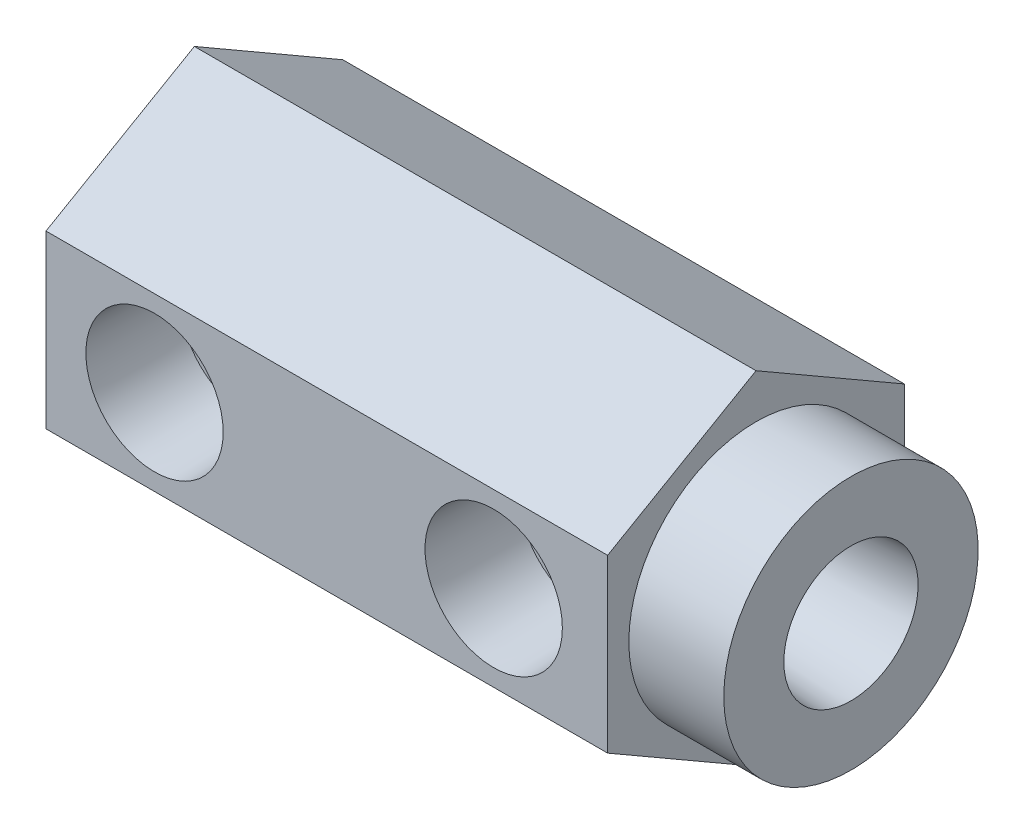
SolidWorks part; units mm, degrees
ref_plane "Front Plane" through (0, 0, 0) normal (0, 0, 1) x (1, 0, 0)
ref_plane "Top Plane" through (0, 0, 0) normal (0, 1, 0) x (1, 0, 0)
ref_plane "Right Plane" through (0, 0, 0) normal (1, 0, 0) x (0, 0, -1)
sketch "Sketch1" plane through (0, 0, 0) normal (1, 0, 0) x (0, 0, -1)
  line L0 (0, 14.1148) -> (0, -14.1148) construction
  line L1 (-11.1125, -6.4158) -> (0, -12.8316)
  line L2 (0, -12.8316) -> (11.1125, -6.4158)
  line L3 (11.1125, -6.4158) -> (11.1125, 6.4158)
  line L4 (11.1125, 6.4158) -> (0, 12.8316)
  line L5 (0, 12.8316) -> (-11.1125, 6.4158)
  line L6 (-11.1125, 6.4158) -> (-11.1125, -6.4158)
  circle A0 centre (0, 0) radius 11.1125 construction
  dimension "D1" = 22.225
extrude "Boss-Extrude1" add sketch "Sketch1" along normal blind 42.0624 separate body
sketch "Sketch2" plane through (0, 0, 0) normal (-1, 0, 0) x (0, 0, 1)
  circle A1 centre (0, 0) radius 9.525
  dimension "D1" = 19.05
extrude "Boss-Extrude2" add sketch "Sketch2" against normal blind 49.1744
hole_wizard "1/8 NPT Tapped Hole1" positions "Sketch4" profile "Sketch3" size "1/8" standard "Ansi Inch"
sketch "Sketch4" plane through (0, 0, 11.1125) normal (0, 0, 1) x (1, 0, 0)
  line L0 (12.2238, 0) -> (-12.2238, 0) construction
  line L1 (0, -12.2237) -> (0, 12.2238) construction
  point P0 (8.128, 0)
  point P1 (33.528, 0)
  dimension "D1" = 8.128
  dimension "D2" = 25.4
sketch "Sketch3" plane through (8.128, 0, 11.1125) normal (1, 0, 0) x (0, -1, 0)
  line L0 (0, 0) -> (0, 18.4085)
  line L1 (4.2164, 15.875) -> (0, 18.4085)
  line L2 (-4.2164, 15.875) -> (0, 18.4085) construction
  line L3 (4.2164, 15.875) -> (4.2164, 6.924)
  line L4 (4.2164, 6.924) -> (4.9362, 6.924)
  line L5 (4.9362, 6.924) -> (5.1435, 0)
  line L6 (-4.9362, 6.924) -> (-5.1435, 0) construction
  line L7 (5.1435, 0) -> (0, 0)
  line L8 (0, -6.35) -> (0, 107.95) construction
  line L11 (-4.2164, 6.924) -> (-4.9362, 6.924) construction
  dimension "Tap Drill Dia." = 8.4328
  dimension "Tap Drill Depth" = 15.875
  dimension "Thread Dia." = 10.287
  dimension "Thread Angle" = 3.43
  dimension "Thread Depth" = 6.924
  dimension "Drill Angle" = 118
hole_wizard "1/8 NPT Tapped Hole2" positions "Sketch6" profile "Sketch5" size "1/8" standard "Ansi Inch"
sketch "Sketch6" plane through (0, 0, -11.1125) normal (0, 0, -1) x (-1, 0, 0)
  line L0 (12.2238, 0) -> (-12.2238, 0) construction
  line L1 (0, 12.2238) -> (0, -12.2238) construction
  point P0 (-8.128, 0)
  dimension "D1" = 8.128
sketch "Sketch5" plane through (8.128, 0, -11.1125) normal (1, 0, 0) x (0, 1, 0)
  line L0 (0, 0) -> (0, 21.5835)
  line L1 (4.2164, 19.05) -> (0, 21.5835)
  line L2 (-4.2164, 19.05) -> (0, 21.5835) construction
  line L3 (4.2164, 19.05) -> (4.2164, 6.924)
  line L4 (4.2164, 6.924) -> (4.9362, 6.924)
  line L5 (4.9362, 6.924) -> (5.1435, 0)
  line L6 (-4.9362, 6.924) -> (-5.1435, 0) construction
  line L7 (5.1435, 0) -> (0, 0)
  line L8 (0, -6.35) -> (0, 107.95) construction
  line L11 (-4.2164, 6.924) -> (-4.9362, 6.924) construction
  dimension "Tap Drill Dia." = 8.4328
  dimension "Tap Drill Depth" = 19.05
  dimension "Thread Dia." = 10.287
  dimension "Thread Angle" = 3.43
  dimension "Thread Depth" = 6.924
  dimension "Drill Angle" = 118
hole_wizard "#21 (0.159) Diameter Hole1" positions "Sketch8" profile "Sketch7" hole size "#21" standard "Ansi Inch"
sketch "Sketch8" plane through (49.1744, 0, 0) normal (1, 0, 0) x (0, 0, -1)
  circle A0 centre (0, 0) radius 9.525 construction
  point P0 (0, 0)
sketch "Sketch7" plane through (49.1744, 0, 0) normal (0, 1, 0) x (0, 0, -1)
  line L0 (0, 0) -> (0, 42.4883)
  line L1 (0, 42.4883) -> (2.0193, 41.275)
  line L2 (2.0193, 41.275) -> (2.0193, 0)
  line L5 (2.0193, 0) -> (0, 0)
  line L10 (0, 42.4883) -> (-2.0193, 41.275) construction
  line L11 (0, -6.35) -> (0, 107.95) construction
  dimension "Hole Dia." = 4.0386
  dimension "Hole Depth" = 41.275
  dimension "Drill Angle" = 118
hole_wizard "3/16 (0.1875) Diameter Hole1" positions "Sketch10" profile "Sketch9" hole size "3/16" standard "Ansi Inch"
sketch "Sketch10" plane through (49.1744, 0, 0) normal (1, 0, 0) x (0, 0, -1)
  circle A0 centre (0, 0) radius 2.0193 construction
  point P0 (0, 0)
sketch "Sketch9" plane through (49.1744, 0, 0) normal (0, 1, 0) x (0, 0, -1)
  line L0 (0, 0) -> (0, 31.4028)
  line L1 (0, 31.4028) -> (2.3812, 29.972)
  line L2 (2.3812, 29.972) -> (2.3812, 0)
  line L5 (2.3812, 0) -> (0, 0)
  line L10 (0, 31.4028) -> (-2.3813, 29.972) construction
  line L11 (0, -6.35) -> (0, 107.95) construction
  dimension "Hole Dia." = 4.7625
  dimension "Hole Depth" = 29.972
  dimension "Drill Angle" = 118
sketch "Sketch11" plane through (0, 0, 0) normal (0, 0, 1) x (1, 0, 0)
  line L0 (49.1744, -9.525) -> (49.1744, 9.525) construction
  line L1 (49.1744, 0) -> (49.1744, 5.0292)
  line L5 (49.1744, 5.0292) -> (42.2402, 4.6658)
  line L6 (42.2402, 4.3688) -> (42.2402, 4.6658)
  line L7 (42.2402, 4.3688) -> (26.9494, 4.3688)
  line L8 (26.9494, 0) -> (26.9494, 4.3688)
  line L9 (0, 0) -> (50000, 0) construction
  line L10 (0, 6.4158) -> (0, -6.4158) construction
  line L11 (26.9494, 0) -> (49.1744, 0)
  point P13 (0, 0)
  dimension "D1" = 22.225
  dimension "D2" = 10.0584
  dimension "D3" = 3
  dimension "D4" = 6.9342
  dimension "D5" = 8.7376
revolve "Cut-Revolve1" cut sketch "Sketch11" angle 360 about L9
